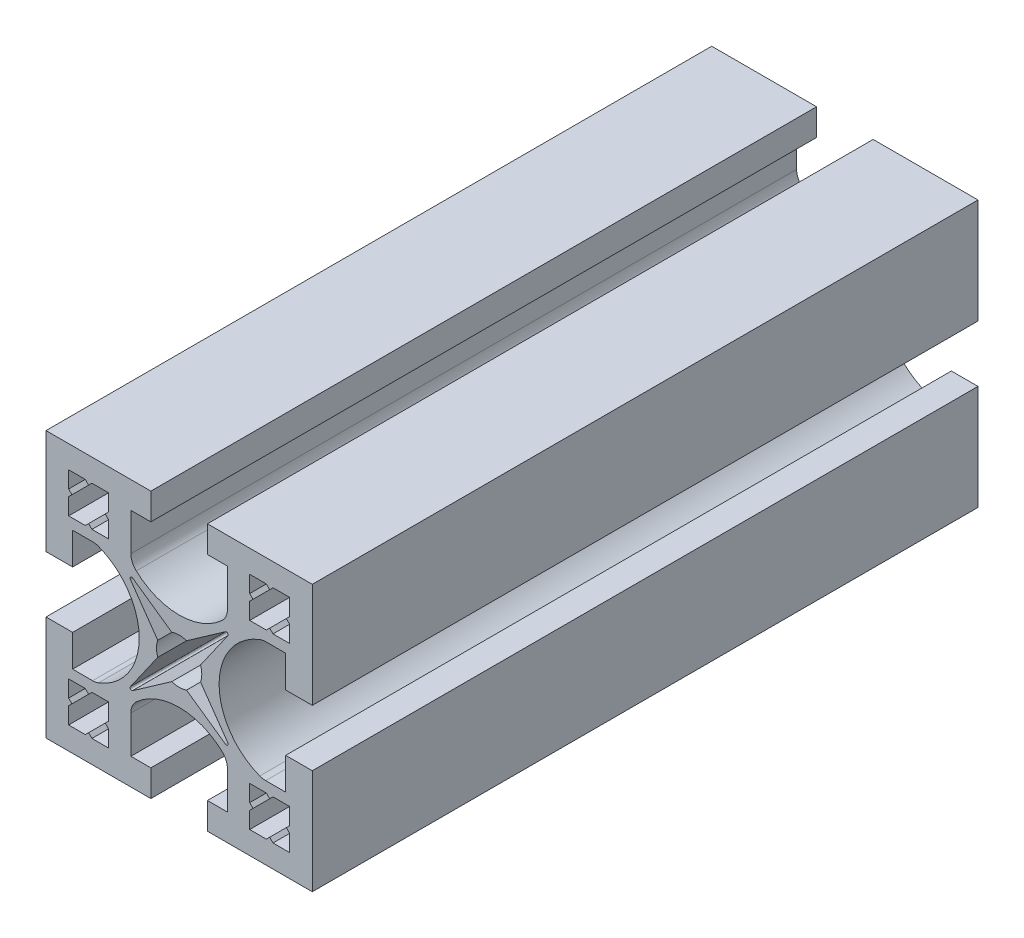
SolidWorks part; units mm, degrees
ref_plane "前基準面" through (0, 0, 0) normal (0, 0, 1) x (1, 0, 0)
ref_plane "上基準面" through (0, 0, 0) normal (0, 1, 0) x (1, 0, 0)
ref_plane "右基準面" through (0, 0, 0) normal (1, 0, 0) x (0, 0, -1)
sketch "草圖1" plane through (0, 0, 0) normal (0, 0, 1) x (1, 0, 0)
  line L0 (0, 55.018) -> (0, 0) construction
  line L1 (0, 0) -> (-102.139, 0) construction
  line L2 (-20, 4.25) -> (-20, 20)
  line L3 (-20, 20) -> (-4.25, 20)
  line L4 (-4.25, 20) -> (-4.25, 16)
  line L5 (-4.25, 16) -> (-7.25, 16)
  line L6 (-7.25, 16) -> (-7.25, 10.3583)
  line L7 (-20, 4.25) -> (-16, 4.25)
  line L8 (-16, 4.25) -> (-16, 9.0383)
  line L9 (-16, 9.0383) -> (-13, 9.0383)
  line L10 (-16.6, 16.6) -> (-14.1, 16.6)
  line L11 (-14.1, 16.6) -> (-13.6, 16.1)
  line L12 (-13.6, 16.1) -> (-13.1, 16.6)
  line L13 (-13.1, 16.6) -> (-10.6, 16.6)
  line L14 (-10.6, 16.6) -> (-10.6, 14.1)
  line L15 (-10.6, 14.1) -> (-11.1, 13.6)
  line L16 (-11.1, 13.6) -> (-10.6, 13.1)
  line L17 (-10.6, 13.1) -> (-10.6, 10.6)
  line L18 (-10.6, 10.6) -> (-13.1, 10.6)
  line L19 (-13.1, 10.6) -> (-13.6, 11.1)
  line L20 (-13.6, 11.1) -> (-14.1, 10.6)
  line L21 (-14.1, 10.6) -> (-16.6, 10.6)
  line L22 (-16.6, 10.6) -> (-16.6, 13.1)
  line L23 (-16.6, 13.1) -> (-16.1, 13.6)
  line L24 (-16.1, 13.6) -> (-16.6, 14.1)
  line L25 (-16.6, 14.1) -> (-16.6, 16.6)
  line L26 (-1.1087, 3.2142) -> (-6.9703, 7.3185)
  line L27 (-7.3185, 6.9703) -> (-3.2142, 1.1087)
  line L28 (0, 0) -> (-20, 20) construction
  line L29 (-13.6, 16.1) -> (-13.6, 11.1) construction
  line L30 (-16.1, 13.6) -> (-11.1, 13.6) construction
  line L31 (16.1, 13.6) -> (11.1, 13.6) construction
  line L32 (13.6, 16.1) -> (13.6, 11.1) construction
  line L33 (0, 0) -> (20, 20) construction
  line L34 (7.3185, 6.9703) -> (3.2142, 1.1087)
  line L35 (1.1087, 3.2142) -> (6.9703, 7.3185)
  line L36 (16.6, 14.1) -> (16.6, 16.6)
  line L37 (16.1, 13.6) -> (16.6, 14.1)
  line L38 (16.6, 13.1) -> (16.1, 13.6)
  line L39 (16.6, 10.6) -> (16.6, 13.1)
  line L40 (14.1, 10.6) -> (16.6, 10.6)
  line L41 (13.6, 11.1) -> (14.1, 10.6)
  line L42 (13.1, 10.6) -> (13.6, 11.1)
  line L43 (10.6, 10.6) -> (13.1, 10.6)
  line L44 (10.6, 13.1) -> (10.6, 10.6)
  line L45 (11.1, 13.6) -> (10.6, 13.1)
  line L46 (10.6, 14.1) -> (11.1, 13.6)
  line L47 (10.6, 16.6) -> (10.6, 14.1)
  line L48 (13.1, 16.6) -> (10.6, 16.6)
  line L49 (13.6, 16.1) -> (13.1, 16.6)
  line L50 (14.1, 16.6) -> (13.6, 16.1)
  line L51 (16.6, 16.6) -> (14.1, 16.6)
  line L52 (16, 9.0383) -> (13, 9.0383)
  line L53 (16, 4.25) -> (16, 9.0383)
  line L54 (20, 4.25) -> (16, 4.25)
  line L55 (7.25, 16) -> (7.25, 10.3583)
  line L56 (4.25, 16) -> (7.25, 16)
  line L57 (4.25, 20) -> (4.25, 16)
  line L58 (20, 20) -> (4.25, 20)
  line L59 (20, 4.25) -> (20, 20)
  line L60 (0, 0) -> (20, -20) construction
  line L61 (13.6, -16.1) -> (13.6, -11.1) construction
  line L62 (16.1, -13.6) -> (11.1, -13.6) construction
  line L63 (-16.1, -13.6) -> (-11.1, -13.6) construction
  line L64 (-13.6, -16.1) -> (-13.6, -11.1) construction
  line L65 (0, 0) -> (-20, -20) construction
  line L66 (20, -4.25) -> (20, -20)
  line L67 (20, -20) -> (4.25, -20)
  line L68 (4.25, -20) -> (4.25, -16)
  line L69 (4.25, -16) -> (7.25, -16)
  line L70 (7.25, -16) -> (7.25, -10.3583)
  line L71 (20, -4.25) -> (16, -4.25)
  line L72 (16, -4.25) -> (16, -9.0383)
  line L73 (16, -9.0383) -> (13, -9.0383)
  line L74 (16.6, -16.6) -> (14.1, -16.6)
  line L75 (14.1, -16.6) -> (13.6, -16.1)
  line L76 (13.6, -16.1) -> (13.1, -16.6)
  line L77 (13.1, -16.6) -> (10.6, -16.6)
  line L78 (10.6, -16.6) -> (10.6, -14.1)
  line L79 (10.6, -14.1) -> (11.1, -13.6)
  line L80 (11.1, -13.6) -> (10.6, -13.1)
  line L81 (10.6, -13.1) -> (10.6, -10.6)
  line L82 (10.6, -10.6) -> (13.1, -10.6)
  line L83 (13.1, -10.6) -> (13.6, -11.1)
  line L84 (13.6, -11.1) -> (14.1, -10.6)
  line L85 (14.1, -10.6) -> (16.6, -10.6)
  line L86 (16.6, -10.6) -> (16.6, -13.1)
  line L87 (16.6, -13.1) -> (16.1, -13.6)
  line L88 (16.1, -13.6) -> (16.6, -14.1)
  line L89 (16.6, -14.1) -> (16.6, -16.6)
  line L90 (1.1087, -3.2142) -> (6.9703, -7.3185)
  line L91 (7.3185, -6.9703) -> (3.2142, -1.1087)
  line L92 (-7.3185, -6.9703) -> (-3.2142, -1.1087)
  line L93 (-1.1087, -3.2142) -> (-6.9703, -7.3185)
  line L94 (-16.6, -14.1) -> (-16.6, -16.6)
  line L95 (-16.1, -13.6) -> (-16.6, -14.1)
  line L96 (-16.6, -13.1) -> (-16.1, -13.6)
  line L97 (-16.6, -10.6) -> (-16.6, -13.1)
  line L98 (-14.1, -10.6) -> (-16.6, -10.6)
  line L99 (-13.6, -11.1) -> (-14.1, -10.6)
  line L100 (-13.1, -10.6) -> (-13.6, -11.1)
  line L101 (-10.6, -10.6) -> (-13.1, -10.6)
  line L102 (-10.6, -13.1) -> (-10.6, -10.6)
  line L103 (-11.1, -13.6) -> (-10.6, -13.1)
  line L104 (-10.6, -14.1) -> (-11.1, -13.6)
  line L105 (-10.6, -16.6) -> (-10.6, -14.1)
  line L106 (-13.1, -16.6) -> (-10.6, -16.6)
  line L107 (-13.6, -16.1) -> (-13.1, -16.6)
  line L108 (-14.1, -16.6) -> (-13.6, -16.1)
  line L109 (-16.6, -16.6) -> (-14.1, -16.6)
  line L110 (-16, -9.0383) -> (-13, -9.0383)
  line L111 (-16, -4.25) -> (-16, -9.0383)
  line L112 (-20, -4.25) -> (-16, -4.25)
  line L113 (-7.25, -16) -> (-7.25, -10.3583)
  line L114 (-4.25, -16) -> (-7.25, -16)
  line L115 (-4.25, -20) -> (-4.25, -16)
  line L116 (-20, -20) -> (-4.25, -20)
  line L117 (-20, -4.25) -> (-20, -20)
  arc A0 (-6.4464, 8.5219) -> (6.4464, 8.5219) centre (0, 15.5) ccw
  arc A1 (-12.1071, 8.8735) -> (-12.1071, -8.8735) centre (-15.5, 0) cw
  arc A2 (-3.2142, -1.1087) -> (-3.2142, 1.1087) centre (0, 0) cw
  arc A3 (-1.1087, 3.2142) -> (1.1087, 3.2142) centre (0, 0) cw
  arc A4 (-6.9703, 7.3185) -> (-7.3185, 6.9703) centre (-7.1137, 7.1137) ccw
  arc A5 (-13, 9.0383) -> (-12.1071, 8.8735) centre (-13, 6.5383) cw
  arc A6 (-7.25, 10.3583) -> (-6.4464, 8.5219) centre (-4.75, 10.3583) ccw
  arc A7 (7.25, 10.3583) -> (6.4464, 8.5219) centre (4.75, 10.3583) cw
  arc A8 (13, 9.0383) -> (12.1071, 8.8735) centre (13, 6.5383) ccw
  arc A9 (6.9703, 7.3185) -> (7.3185, 6.9703) centre (7.1137, 7.1137) cw
  arc A10 (3.2142, -1.1087) -> (3.2142, 1.1087) centre (0, 0) ccw
  arc A11 (12.1071, 8.8735) -> (12.1071, -8.8735) centre (15.5, 0) ccw
  arc A12 (6.9703, -7.3185) -> (7.3185, -6.9703) centre (7.1137, -7.1137) ccw
  arc A13 (13, -9.0383) -> (12.1071, -8.8735) centre (13, -6.5383) cw
  arc A14 (7.25, -10.3583) -> (6.4464, -8.5219) centre (4.75, -10.3583) ccw
  arc A15 (-7.25, -10.3583) -> (-6.4464, -8.5219) centre (-4.75, -10.3583) cw
  arc A16 (-13, -9.0383) -> (-12.1071, -8.8735) centre (-13, -6.5383) ccw
  arc A17 (-6.9703, -7.3185) -> (-7.3185, -6.9703) centre (-7.1137, -7.1137) cw
  arc A18 (-1.1087, -3.2142) -> (1.1087, -3.2142) centre (0, 0) ccw
  arc A19 (-6.4464, -8.5219) -> (6.4464, -8.5219) centre (0, -15.5) cw
  point P40 (-8.1317, 8.1317)
  point P80 (8.1317, 8.1317)
  point P146 (8.1317, -8.1317)
  point P147 (-8.1317, -8.1317)
  dimension "D6" = 3.4
  dimension "D7" = 8.5
  dimension "D9" = 9.5
  dimension "D18" = 0.25
  dimension "D19" = 2.5
  dimension "D20" = 2.5
  dimension "D1" = 0.5
  dimension "D2" = 6
  dimension "D3" = 6
  dimension "D4" = 20
  dimension "D5" = 20
  dimension "D8" = 14.5
  dimension "D10" = 4
  dimension "D11" = 13.6
  dimension "D12" = 13.6
  dimension "D13" = 0.5
  dimension "D14" = 0.5
  dimension "D15" = 4.5
  dimension "D16" = 4.5
  dimension "D17" = 11.5
  dimension "D21" = 20
extrude "填料-伸長1" add sketch "草圖1" along normal mid plane 100
